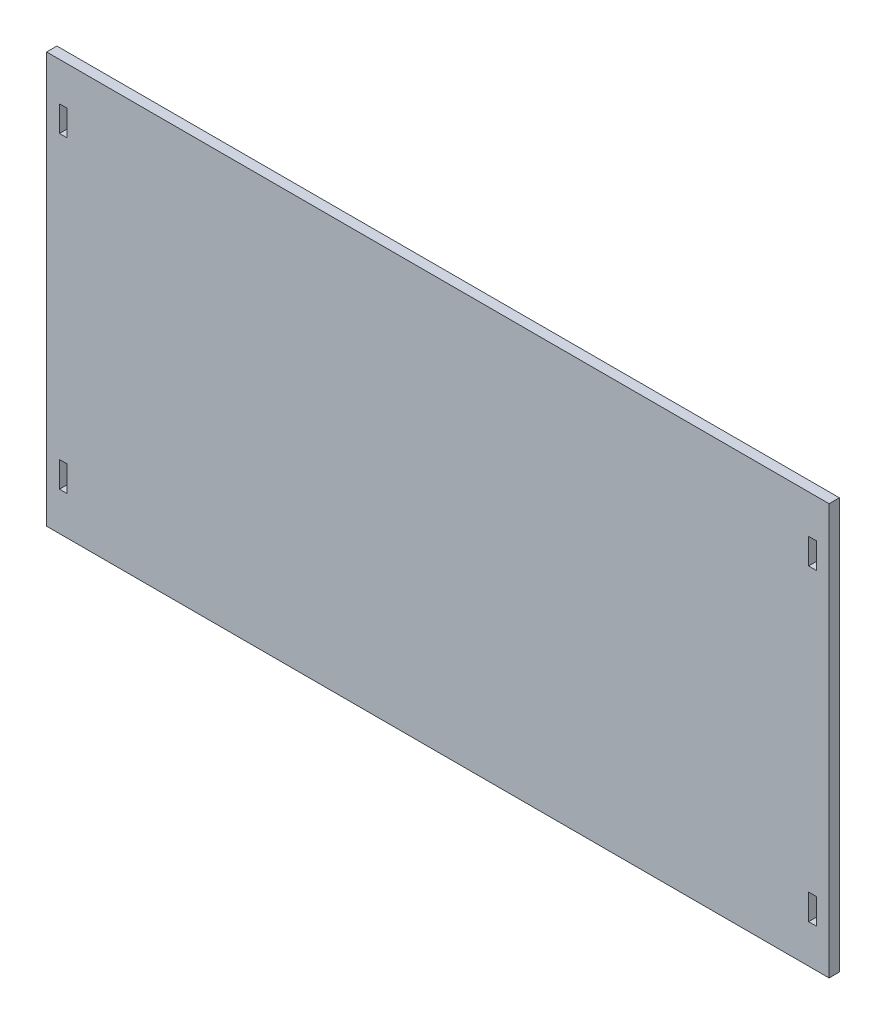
SolidWorks part; units mm, degrees
ref_plane "Front Plane" through (0, 0, 0) normal (0, 0, 1) x (1, 0, 0)
ref_plane "Top Plane" through (0, 0, 0) normal (0, 1, 0) x (1, 0, 0)
ref_plane "Right Plane" through (0, 0, 0) normal (1, 0, 0) x (0, 0, -1)
sketch "Sketch1" plane through (0, 0, 0) normal (0, 0, 1) x (1, 0, 0)
  line L0 (-63.8402, 21.1042) -> (-63.8402, 31.1042)
  line L2 (-63.8402, 21.1042) -> (-63.8402, -128.8958)
  line L3 (-63.8402, -128.8958) -> (240.9598, -128.8958)
  line L4 (240.9598, 21.1042) -> (240.9598, -128.8958)
  line L5 (-63.8402, 21.1042) -> (240.9598, -128.8958) construction
  line L6 (-63.8402, -128.8958) -> (240.9598, 21.1042) construction
  line L7 (-63.8402, 31.1042) -> (240.9598, 31.1042)
  line L8 (240.9598, 31.1042) -> (240.9598, 21.1042)
  point P0 (88.5598, -53.8958)
  dimension "D1" = 304.8
  dimension "D2" = 150
  dimension "D3" = 10
  dimension "D4" = 10
extrude "Boss-Extrude1" add sketch "Sketch1" along normal blind 4
sketch "Sketch2" plane through (0, 0, 0) normal (0, 0, 1) x (1, 0, 0)
  line L0 (240.9598, 31.1042) -> (-63.8402, 31.1042) construction
  line L3 (-58.8402, 16.1042) -> (-63.8402, 16.1042) construction
  line L4 (-63.8402, 31.1042) -> (-63.8402, -128.8958) construction
  line L5 (-63.8402, -113.8958) -> (-58.8402, -113.8958) construction
  line L6 (-58.8402, 16.1042) -> (-55.8402, 16.1042)
  line L7 (-58.8402, 16.1042) -> (-58.8402, 6.1042)
  line L8 (-58.8402, 6.1042) -> (-55.8402, 6.1042)
  line L9 (-55.8402, 16.1042) -> (-55.8402, 6.1042)
  line L10 (-58.8402, -113.8958) -> (-58.8402, -128.8958) construction
  line L11 (-63.8402, -128.8958) -> (240.9598, -128.8958) construction
  line L12 (240.9598, -113.8958) -> (235.9598, -113.8958) construction
  line L13 (-58.8402, -113.8958) -> (-55.8402, -113.8958)
  line L14 (-58.8402, -113.8958) -> (-58.8402, -103.8958)
  line L15 (-58.8402, -103.8958) -> (-55.8402, -103.8958)
  line L16 (-55.8402, -113.8958) -> (-55.8402, -103.8958)
  line L17 (240.9598, -128.8958) -> (240.9598, 31.1042) construction
  line L18 (235.9598, -113.8958) -> (235.9598, -128.8958) construction
  line L20 (235.9598, -113.8958) -> (232.9598, -113.8958)
  line L21 (235.9598, -113.8958) -> (235.9598, -103.8958)
  line L22 (235.9598, -103.8958) -> (232.9598, -103.8958)
  line L23 (232.9598, -113.8958) -> (232.9598, -103.8958)
  line L24 (240.9598, 16.1042) -> (235.9598, 16.1042) construction
  line L26 (235.9598, 16.1042) -> (232.9598, 16.1042)
  line L27 (235.9598, 16.1042) -> (235.9598, 6.1042)
  line L28 (235.9598, 6.1042) -> (232.9598, 6.1042)
  line L29 (232.9598, 16.1042) -> (232.9598, 6.1042)
  point P2 (-57.3402, 16.1042)
  point P31 (234.4598, 16.1042)
  dimension "D1" = 5
  dimension "D2" = 15
  dimension "D3" = 10
  dimension "D4" = 3
  dimension "D5" = 15
  dimension "D6" = 5
  dimension "D7" = 10
  dimension "D8" = 3
  dimension "D9" = 15
  dimension "D10" = 5
  dimension "D11" = 10
  dimension "D12" = 3
  dimension "D13" = 10
  dimension "D14" = 5
  dimension "D15" = 15
  dimension "D16" = 3
extrude "Cut-Extrude1" cut sketch "Sketch2" along normal up to surface (4 mm away)
equation "\"thickness of material\"= 4mm"
equation "\"Length\"= 120mm"
equation "\"width\"= 60mm"
equation "\"length of strip\"= 60mm"
equation "\"width of strip\"= 10mm"
